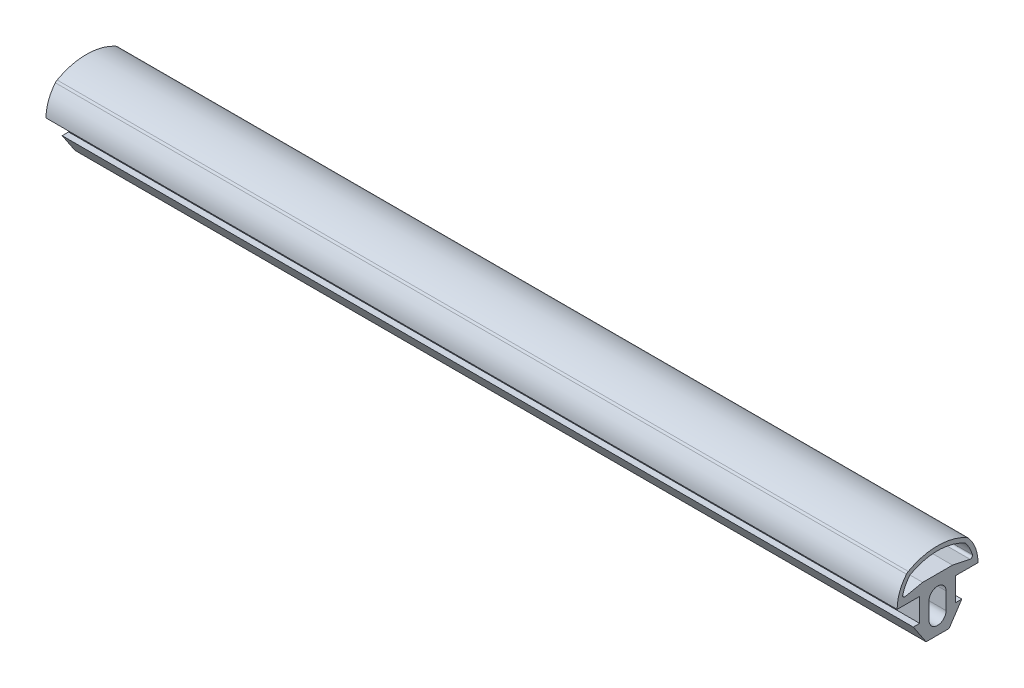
SolidWorks part; units mm, degrees
ref_plane "Front Plane" through (0, 0, 0) normal (0, 0, 1) x (1, 0, 0)
ref_plane "Top Plane" through (0, 0, 0) normal (0, 1, 0) x (1, 0, 0)
ref_plane "Right Plane" through (0, 0, 0) normal (1, 0, 0) x (0, 0, -1)
sketch3d "3DSketch1"
  line L0 (0, 0, 0) -> (200, 0, 0)
other "Tiivistekumit 1.6026 TIIVISTEKUMI(1)"
ref_plane "Plane1" through (0, 0, 0) normal (1, 0, 0) x (0, 0, -1)
sketch "Sketch1" plane through (0, 0, 0) normal (1, 0, 0) x (0, 0, -1)
  line L0 (-3.2378, 3.4656) -> (-7.3439, 2.6218)
  line L1 (3.7622, 3.4656) -> (-3.2378, 3.4656)
  line L2 (7.8684, 2.6218) -> (3.7622, 3.4656)
  line L3 (2.2622, -1.0344) -> (2.2622, -5.0344)
  line L4 (-1.7378, -5.0345) -> (-1.7378, -1.0344)
  line L5 (-9.2378, 0.9656) -> (-3.9378, 0.9656)
  line L6 (-3.9378, 0.9656) -> (-3.9378, -4.5344)
  line L7 (-3.9378, -4.5344) -> (-5.4378, -4.5344)
  line L8 (-5.4378, -4.5344) -> (-2.4378, -9.0344)
  line L9 (-2.4378, -9.0344) -> (2.9622, -9.0344)
  line L10 (2.9622, -9.0344) -> (5.9622, -4.5344)
  line L11 (5.9622, -4.5344) -> (4.4622, -4.5344)
  line L12 (4.4622, -4.5344) -> (4.4622, 0.9656)
  line L13 (4.4622, 0.9656) -> (9.7622, 0.9656)
  arc A0 (7.8684, 2.6218) -> (8.4507, 3.2457) centre (7.969, 3.1116) ccw
  arc A1 (8.4507, 3.2457) -> (6.8044, 6.3923) centre (0.2622, 0.9656) ccw
  arc A2 (6.662, 6.5104) -> (-6.1376, 6.5104) centre (0.2622, -5.0345) ccw
  arc A3 (-6.28, 6.3923) -> (-7.9262, 3.2457) centre (0.2622, 0.9656) ccw
  arc A4 (-7.9262, 3.2457) -> (-7.3439, 2.6218) centre (-7.4446, 3.1116) ccw
  arc A5 (-1.7378, -5.0345) -> (2.2622, -5.0344) centre (0.2622, -5.0345) ccw
  arc A6 (2.2622, -1.0344) -> (-1.7378, -1.0344) centre (0.2622, -1.0344) ccw
  arc A7 (6.8044, 6.3923) -> (6.662, 6.5104) centre (6.4195, 6.0729) ccw
  arc A8 (-6.1376, 6.5104) -> (-6.28, 6.3923) centre (-5.8952, 6.0731) ccw
  arc A9 (9.7622, 0.9656) -> (7.5741, 7.0307) centre (0.2623, 0.9656) ccw
  arc A10 (7.5741, 7.0307) -> (7.1469, 7.385) centre (6.4195, 6.0729) ccw
  arc A11 (7.1469, 7.385) -> (-6.6224, 7.385) centre (0.2622, -5.0344) ccw
  arc A12 (-6.6224, 7.385) -> (-7.0497, 7.0307) centre (-5.8952, 6.0731) ccw
  arc A13 (-7.0497, 7.0307) -> (-9.2378, 0.9656) centre (0.2622, 0.9656) ccw
  point P38 (0, 0)
